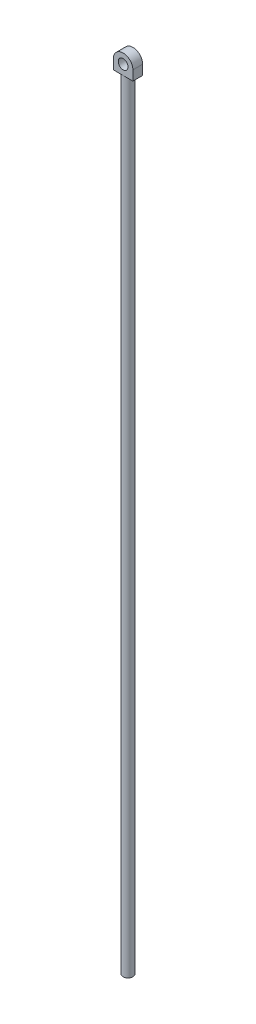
SolidWorks part; units mm, degrees
ref_plane "Front Plane" through (0, 0, 0) normal (0, 0, 1) x (1, 0, 0)
ref_plane "Top Plane" through (0, 0, 0) normal (0, 1, 0) x (1, 0, 0)
ref_plane "Right Plane" through (0, 0, 0) normal (1, 0, 0) x (0, 0, -1)
sketch "Sketch1" plane through (0, 0, 0) normal (0, 0, 1) x (1, 0, 0)
  line L0 (-10, 0) -> (-10, -10)
  line L1 (-10, -10) -> (10, -10)
  line L2 (10, -10) -> (10, 0)
  circle A0 centre (0, 0) radius 5
  arc A1 (10, 0) -> (-10, 0) centre (0, 0) ccw
  dimension "D1" = 20
  dimension "D2" = 10
  dimension "D3" = 10
extrude "Boss-Extrude1" add sketch "Sketch1" along normal mid plane 10
sketch "Sketch2" plane through (0, -10, 0) normal (0, -1, 0) x (1, 0, 0)
  circle A0 centre (0, 0) radius 5
  dimension "D1" = 10
extrude "Boss-Extrude3" add sketch "Sketch2" along normal blind 800
